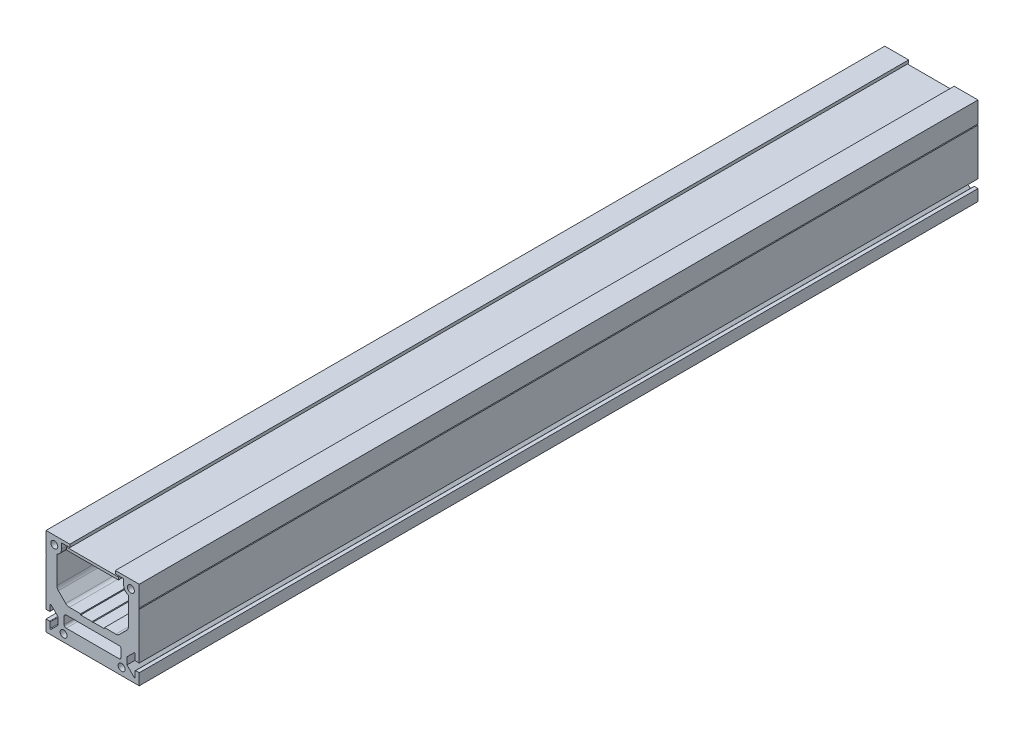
SolidWorks part; units mm, degrees
ref_plane "Ebene vorne" through (0, 0, 0) normal (0, 0, 1) x (1, 0, 0)
ref_plane "Ebene oben" through (0, 0, 0) normal (0, 1, 0) x (1, 0, 0)
ref_plane "Ebene rechts" through (0, 0, 0) normal (1, 0, 0) x (0, 0, -1)
sketch "Skizze1" plane through (0, 0, 0) normal (0, 0, 1) x (1, 0, 0)
  line L0 (-37, 55) -> (37, 55) construction
  line L1 (-45, 0) -> (45, 0)
  line L2 (-45, 0) -> (-45, 85)
  line L3 (-45, 85) -> (45, 85)
  line L4 (45, 0) -> (45, 85)
  circle A0 centre (-37, 55) radius 3.932 construction
  circle A1 centre (37, 55) radius 4.4276 construction
  dimension "D1" = 90
  dimension "D2" = 45
  dimension "D3" = 85
  dimension "D4" = 74
  dimension "D5" = 55
  dimension "D6" = 37
extrude "Linear austragen1" add sketch "Skizze1" against normal blind 810
sketch "Skizze2" plane through (0, 0, 0) normal (0, 0, 1) x (1, 0, 0)
  line L1 (45, 19.05) -> (45, 10.95)
  line L2 (45, 19.05) -> (41.5, 19.05)
  line L3 (41, 19.55) -> (41, 25)
  line L4 (40.1464, 25.3536) -> (33.2, 18.4071)
  line L5 (15.296, 15) -> (21.4231, 15) construction
  line L7 (45, 10.95) -> (41.5, 10.95)
  line L8 (41, 10.45) -> (41, 5)
  line L9 (40.1464, 4.6464) -> (33.2, 11.5929)
  line L10 (33.2, 18.4071) -> (33.2, 11.5929)
  line L11 (45, 0) -> (45, 85) construction
  line L12 (-45, 0) -> (45, 0) construction
  line L13 (0, 0) -> (0, 46.9122) construction
  line L14 (-15.296, 15) -> (-21.4231, 15) construction
  line L15 (-33.2, 18.4071) -> (-33.2, 11.5929)
  line L16 (-40.1464, 4.6464) -> (-33.2, 11.5929)
  line L17 (-41, 10.45) -> (-41, 5)
  line L18 (-45, 10.95) -> (-41.5, 10.95)
  line L19 (-40.1464, 25.3536) -> (-33.2, 18.4071)
  line L20 (-41, 19.55) -> (-41, 25)
  line L21 (-45, 19.05) -> (-41.5, 19.05)
  line L22 (-45, 19.05) -> (-45, 10.95)
  arc A0 (40.1464, 25.3536) -> (41, 25) centre (40.5, 25) cw
  arc A1 (41.5, 19.05) -> (41, 19.55) centre (41.5, 19.55) cw
  arc A2 (41.5, 10.95) -> (41, 10.45) centre (41.5, 10.45) ccw
  arc A3 (40.1464, 4.6464) -> (41, 5) centre (40.5, 5) ccw
  arc A4 (-40.1464, 4.6464) -> (-41, 5) centre (-40.5, 5) cw
  arc A5 (-41.5, 10.95) -> (-41, 10.45) centre (-41.5, 10.45) cw
  arc A6 (-41.5, 19.05) -> (-41, 19.55) centre (-41.5, 19.55) ccw
  arc A7 (-40.1464, 25.3536) -> (-41, 25) centre (-40.5, 25) ccw
  point P14 (41, 19.05)
  point P44 (-41, 19.05)
  dimension "D6" = 0.5
  dimension "D1" = 4
  dimension "D2" = 4.05
  dimension "D3" = 15
  dimension "D4" = 45
  dimension "D5" = 11.8
  dimension "D7" = 10.5
extrude "Linear austragen2" cut sketch "Skizze2" against normal through all
sketch "Skizze3" plane through (0, 0, 0) normal (0, 0, 1) x (1, 0, 0)
  line L0 (-45, 0) -> (45, 0) construction
  line L1 (-30, 77) -> (-30, 82.1)
  line L2 (30, 77) -> (30, 82.1)
  line L3 (-27.5, 13) -> (27.5, 13)
  line L4 (-28, 7) -> (28, 7) construction
  line L5 (-37, 77) -> (37, 77) construction
  line L6 (-34.5, 32) -> (34.5, 32)
  line L7 (-34.5, 32) -> (-34.5, 70.4617)
  line L8 (0, 0) -> (0, 89.6031) construction
  line L9 (-30, 82.1) -> (30, 82.1)
  line L11 (-27.5, 13) -> (-27.5, 24)
  line L12 (-27.5, 24) -> (27.5, 24)
  line L13 (27.5, 13) -> (27.5, 24)
  line L14 (-27.5, 13) -> (27.5, 24) construction
  line L15 (-27.5, 24) -> (27.5, 13) construction
  line L16 (34.5, 32) -> (34.5, 70.4617)
  line L17 (-34.5, 32) -> (32.6045, 84.5166) construction
  line L18 (-32.6045, 84.5166) -> (34.5, 32) construction
  circle A0 centre (28, 7) radius 3.35
  circle A1 centre (-28, 7) radius 3.35
  circle A2 centre (-37, 77) radius 3.35
  circle A3 centre (37, 77) radius 3.35
  arc A4 (-34.5, 70.4617) -> (-30, 77) centre (-37, 77) ccw
  arc A5 (30, 77) -> (34.5, 70.4617) centre (37, 77) ccw
  point P14 (0, 18.5)
  point P22 (0, 59)
  dimension "D5" = 6.7
  dimension "D6" = 6.7
  dimension "D9" = 77
  dimension "D10" = 37
  dimension "D7" = 6.7
  dimension "D8" = 6.7
  dimension "D19" = 14
  dimension "D20" = 14
  dimension "D1" = 7
  dimension "D3" = 28
  dimension "D4" = 28
  dimension "D11" = 24
  dimension "D12" = 13
  dimension "D13" = 55
  dimension "D14" = 32
  dimension "D15" = 34.5
  dimension "D16" = 37
  dimension "D21" = 34.5
  dimension "D22" = 50.1
extrude "Linear austragen3" cut sketch "Skizze3" against normal through all
sketch "Skizze6" plane through (0, 0, 0) normal (0, 0, 1) x (1, 0, 0)
  line L0 (0, 0) -> (0, 103.081) construction
  line L2 (-22, 65.3729) -> (22, 65.3729)
  line L3 (-22, 65.3729) -> (-22, 94.3006)
  line L4 (-22, 94.3006) -> (22, 94.3006)
  line L5 (22, 65.3729) -> (22, 94.3006)
  line L6 (-22, 65.3729) -> (22, 94.3006) construction
  line L7 (-22, 94.3006) -> (22, 65.3729) construction
  point P3 (0, 79.8367)
  dimension "D1" = 44
extrude "Linear austragen4" cut sketch "Skizze6" against normal through all
chamfer "Fase1" distance 10 angle 45 2 edges at (34.5, 32, -405) (-34.5, 32, -405)
fillet "Verrundung8" radius 5 4 edges at (34.5, 42, -405) (24.5, 32, -405) (-24.5, 32, -405) (-34.5, 42, -405)
fillet "Verrundung9" radius 2 4 edges at (27.5, 13, -405) (27.5, 24, -405) (-27.5, 13, -405) (-27.5, 24, -405)
sketch "Skizze9" plane through (0, 0, 0) normal (0, 0, 1) x (1, 0, 0)
  line L1 (-45, 0) -> (45, 0) construction
  line L2 (21.4078, 64.5) -> (44.5, 64.5) construction
  line L4 (45, 19.05) -> (45, 85) construction
  line L5 (44.5, 64.5) -> (45.7227, 65.7227)
  line L6 (44.5, 64.5) -> (45.7227, 63.2773)
  line L7 (45.7227, 65.7227) -> (45.7227, 63.2773)
  line L8 (0, 0) -> (0, 76.3036) construction
  line L9 (-45.7227, 65.7227) -> (-45.7227, 63.2773)
  line L10 (-44.5, 64.5) -> (-45.7227, 63.2773)
  line L11 (-44.5, 64.5) -> (-45.7227, 65.7227)
  dimension "D1" = 0.5
  dimension "D2" = 45
  dimension "D3" = 64.5
extrude "Linear austragen7" cut sketch "Skizze9" against normal through all
sketch "Skizze10" plane through (0, 0, 0) normal (0, 0, 1) x (1, 0, 0)
  line L0 (-11.5, 32) -> (-11.5, 31)
  line L1 (-22.4289, 32) -> (22.4289, 32) construction
  line L2 (-11.5, 31) -> (-0.5, 31)
  line L3 (11.5, 31) -> (11.5, 32)
  line L4 (0, -46.75) -> (0, 46.75) construction
  line L5 (-11.5, 32) -> (11.5, 32)
  line L6 (-0.5, 31) -> (0, 30.5)
  line L7 (0, 30.5) -> (0.5, 31)
  line L8 (0.5, 31) -> (11.5, 31)
  dimension "D1" = 1
  dimension "D2" = 23
  dimension "D3" = 11.5
  dimension "D4" = 45
  dimension "D5" = 0.5
extrude "Linear austragen8" cut sketch "Skizze10" against normal through all
sketch "Skizze11" plane through (0, 0, 0) normal (0, 0, 1) x (1, 0, 0)
  line L0 (-22, 85) -> (-45, 85) construction
  line L1 (-25, 78.5) -> (25, 78.5)
  line L2 (-25, 78.5) -> (-25, 81)
  line L3 (-25, 81) -> (25, 81)
  line L4 (25, 78.5) -> (25, 81)
  dimension "D1" = 2.5
  dimension "D2" = 50
  dimension "D3" = 4
  dimension "D4" = 25
extrude "Linear austragen9" add sketch "Skizze11" against normal through all
